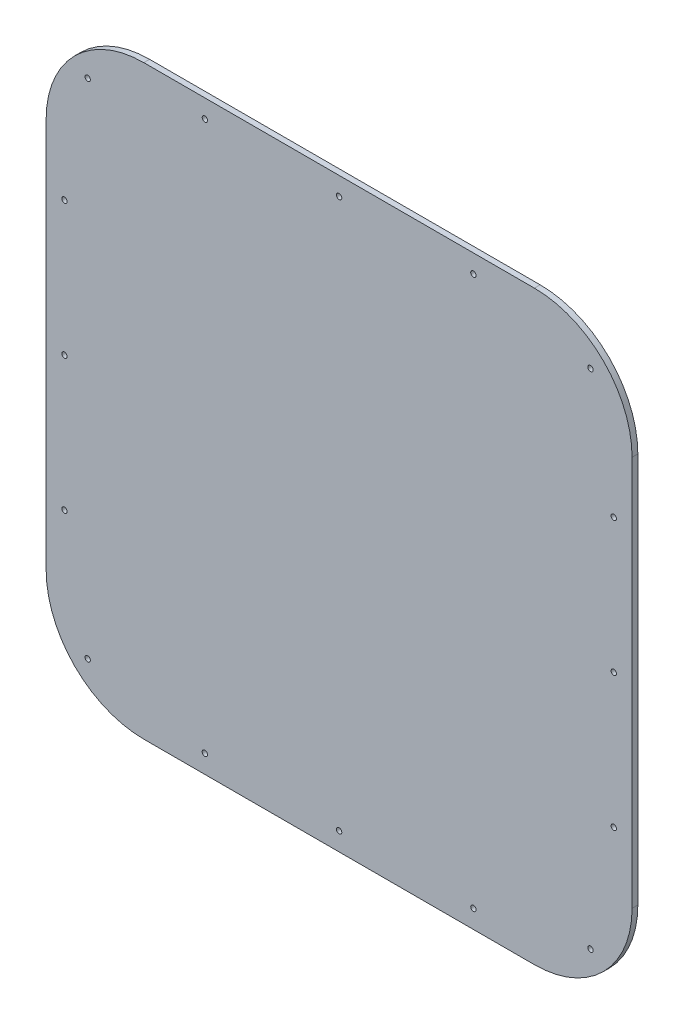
SolidWorks part; units mm, degrees
ref_plane "Front Plane" through (0, 0, 0) normal (0, 0, 1) x (1, 0, 0)
ref_plane "Top Plane" through (0, 0, 0) normal (0, 1, 0) x (1, 0, 0)
ref_plane "Right Plane" through (0, 0, 0) normal (1, 0, 0) x (0, 0, -1)
sketch "Sketch1" plane through (0, 0, 0) normal (0, 0, 1) x (1, 0, 0)
  line L0 (0, 304.8) -> (0, 0) construction
  line L1 (-203.2, 304.8) -> (203.2, 304.8)
  line L2 (-304.8, 203.2) -> (-304.8, -203.2)
  line L3 (-203.2, -304.8) -> (203.2, -304.8)
  line L4 (304.8, 203.2) -> (304.8, -203.2)
  line L5 (-304.8, 0) -> (0, 0) construction
  line L6 (-203.2, -203.2) -> (203.2, 203.2) construction
  line L7 (285.75, 203.2) -> (285.75, -203.2) construction
  line L8 (-203.2, -285.75) -> (203.2, -285.75) construction
  line L9 (-285.75, 203.2) -> (-285.75, -203.2) construction
  line L10 (-203.2, 285.75) -> (203.2, 285.75) construction
  line L11 (-266.7, 203.2) -> (-266.7, -203.2) construction
  line L12 (-203.2, -266.7) -> (203.2, -266.7) construction
  line L13 (266.7, 203.2) -> (266.7, -203.2) construction
  line L14 (-203.2, 266.7) -> (203.2, 266.7) construction
  line L15 (0, 0) -> (285.75, 0) construction
  line L16 (0, 0) -> (0, -285.75) construction
  line L17 (-139.7, 285.75) -> (-139.7, -285.75) construction
  line L18 (139.7, 285.75) -> (139.7, -285.75) construction
  line L19 (285.75, -139.7) -> (-285.75, -139.7) construction
  line L20 (-285.75, 139.7) -> (285.75, 139.7) construction
  line L23 (-304.8, -203.2) -> (-304.8, -304.8) construction
  line L24 (-203.2, -304.8) -> (-304.8, -304.8) construction
  arc A0 (203.2, 304.8) -> (304.8, 203.2) centre (203.2, 203.2) cw
  arc A1 (203.2, -304.8) -> (304.8, -203.2) centre (203.2, -203.2) ccw
  arc A2 (-304.8, -203.2) -> (-203.2, -304.8) centre (-203.2, -203.2) ccw
  arc A3 (-203.2, 304.8) -> (-304.8, 203.2) centre (-203.2, 203.2) ccw
  arc A4 (203.2, -285.75) -> (285.75, -203.2) centre (203.2, -203.2) ccw construction
  arc A5 (-285.75, -203.2) -> (-203.2, -285.75) centre (-203.2, -203.2) ccw construction
  arc A6 (-203.2, 285.75) -> (-285.75, 203.2) centre (-203.2, 203.2) ccw construction
  arc A7 (203.2, 285.75) -> (285.75, 203.2) centre (203.2, 203.2) cw construction
  arc A8 (-266.7, -203.2) -> (-203.2, -266.7) centre (-203.2, -203.2) ccw construction
  arc A9 (203.2, -266.7) -> (266.7, -203.2) centre (203.2, -203.2) ccw construction
  arc A10 (203.2, 266.7) -> (266.7, 203.2) centre (203.2, 203.2) cw construction
  arc A11 (-203.2, 266.7) -> (-266.7, 203.2) centre (-203.2, 203.2) ccw construction
  circle A12 centre (0, 285.75) radius 2.7781
  circle A13 centre (0, -285.75) radius 2.7781
  circle A14 centre (-285.75, 0) radius 2.7781
  circle A15 centre (285.75, 0) radius 2.7781
  circle A16 centre (-261.5717, 261.5717) radius 2.7781
  circle A17 centre (261.5717, 261.5717) radius 2.7781
  circle A18 centre (261.5717, -261.5717) radius 2.7781
  circle A19 centre (-261.5717, -261.5717) radius 2.7781
  circle A20 centre (-139.7, 285.75) radius 2.7781
  circle A21 centre (139.7, 285.75) radius 2.7781
  circle A22 centre (-139.7, -285.75) radius 2.7781
  circle A23 centre (139.7, -285.75) radius 2.7781
  circle A24 centre (-285.75, 139.7) radius 2.7781
  circle A25 centre (-285.75, -139.7) radius 2.7781
  circle A26 centre (285.75, -139.7) radius 2.7781
  circle A27 centre (285.75, 139.7) radius 2.7781
  dimension "D1" = 101.6
  dimension "D5" = 5.5562
  dimension "D2" = 609.6
  dimension "D6" = 139.7
  dimension "D7" = 139.7
  dimension "D8" = 139.7
  dimension "D9" = 139.7
  dimension "D3" = 19.05
  dimension "D4" = 38.1
extrude "Boss-Extrude1" add sketch "Sketch1" along normal blind 6
